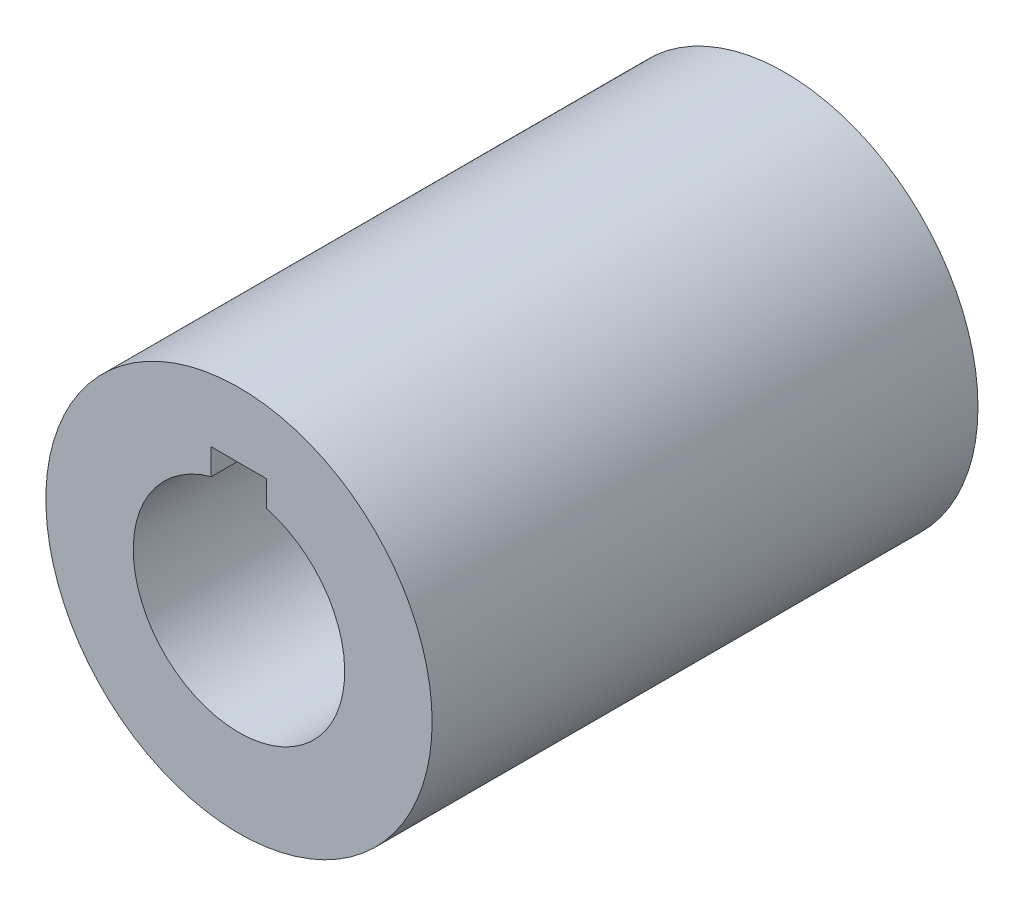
SolidWorks part; units mm, degrees
ref_plane "Alzado" through (0, 0, 0) normal (0, 0, 1) x (1, 0, 0)
ref_plane "Planta" through (0, 0, 0) normal (0, 1, 0) x (1, 0, 0)
ref_plane "Vista lateral" through (0, 0, 0) normal (1, 0, 0) x (0, 0, -1)
sketch "Croquis1" plane through (0, 0, 0) normal (0, 0, 1) x (1, 0, 0)
  line L1 (-2.5, 11.525) -> (2.5, 11.525)
  line L2 (2.5, 11.525) -> (2.5, 9.1911)
  line L4 (-2.5, 11.525) -> (-2.5, 9.1911)
  arc A0 (-2.5, 9.1911) -> (2.5, 9.1911) centre (0, 0) ccw
  circle A1 centre (0, 0) radius 17.4
extrude "Extruir1" add sketch "Croquis1" along normal blind 49.18
